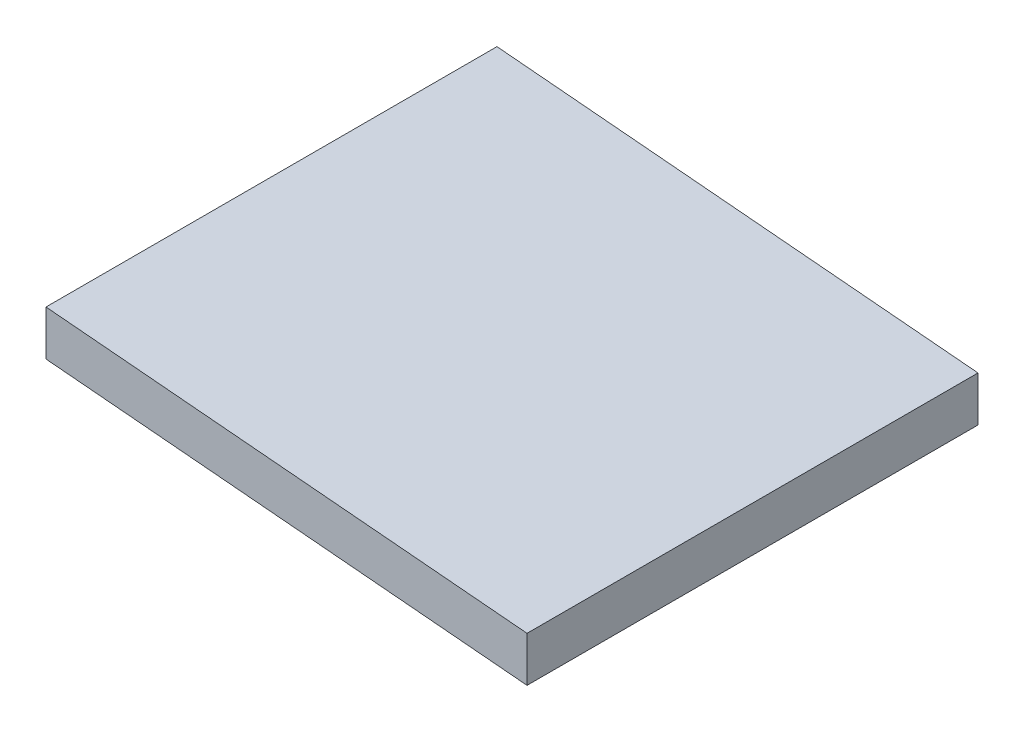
SolidWorks part; units mm, degrees
ref_plane "Ebene vorne" through (0, 0, 0) normal (0, 0, 1) x (1, 0, 0)
ref_plane "Ebene oben" through (0, 0, 0) normal (0, 1, 0) x (1, 0, 0)
ref_plane "Ebene rechts" through (0, 0, 0) normal (1, 0, 0) x (0, 0, -1)
sketch "Skizze1" plane through (0, 0, 0) normal (0, 0, 1) x (1, 0, 0)
  line L0 (0, 0) -> (-32, 2.7996)
  line L1 (-32, 2.7996) -> (-32, 5.7996)
  line L2 (-32, 5.7996) -> (0, 3)
  line L3 (0, 3) -> (0, 0)
  line L4 (0, 0) -> (-42.1721, 0) construction
  dimension "D1" = 32
  dimension "D2" = 3
  dimension "D3" = 5
  dimension "D4" = 3
extrude "Aufsatz-Linear austragen1" add sketch "Skizze1" along normal blind 30
sketch "Skizze2" plane through (0, 0, 0) normal (0, 0, -1) x (-1, 0, 0)
  line L0 (0, 0) -> (0, 20) construction
  line L1 (32, 0) -> (32, 20) construction
  line L2 (0, 0) -> (32, 0) construction
  dimension "D1" = 20
  dimension "D2" = 20
  dimension "D3" = 32
sketch "Skizze3" plane through (0, 0, 0) normal (1, 0, 0) x (0, 0, -1)
  line L0 (0, 0) -> (5, 0) construction
  dimension "D1" = 5
sketch "Skizze4" plane through (-32, 0, 0) normal (-1, 0, 0) x (0, 0, 1)
  line L0 (0, 0) -> (-5, 0) construction
ref_plane "Ebene1" through (-16, 0, 0) normal (1, 0, 0) x (0, 0, -1)
sketch "Skizze5" plane through (-16, 0, 0) normal (1, 0, 0) x (0, 0, -1)
  line L0 (0, 1.5) -> (5, 1.5) construction
  line L1 (0, 0) -> (0, 3) construction
  dimension "D1" = 5
